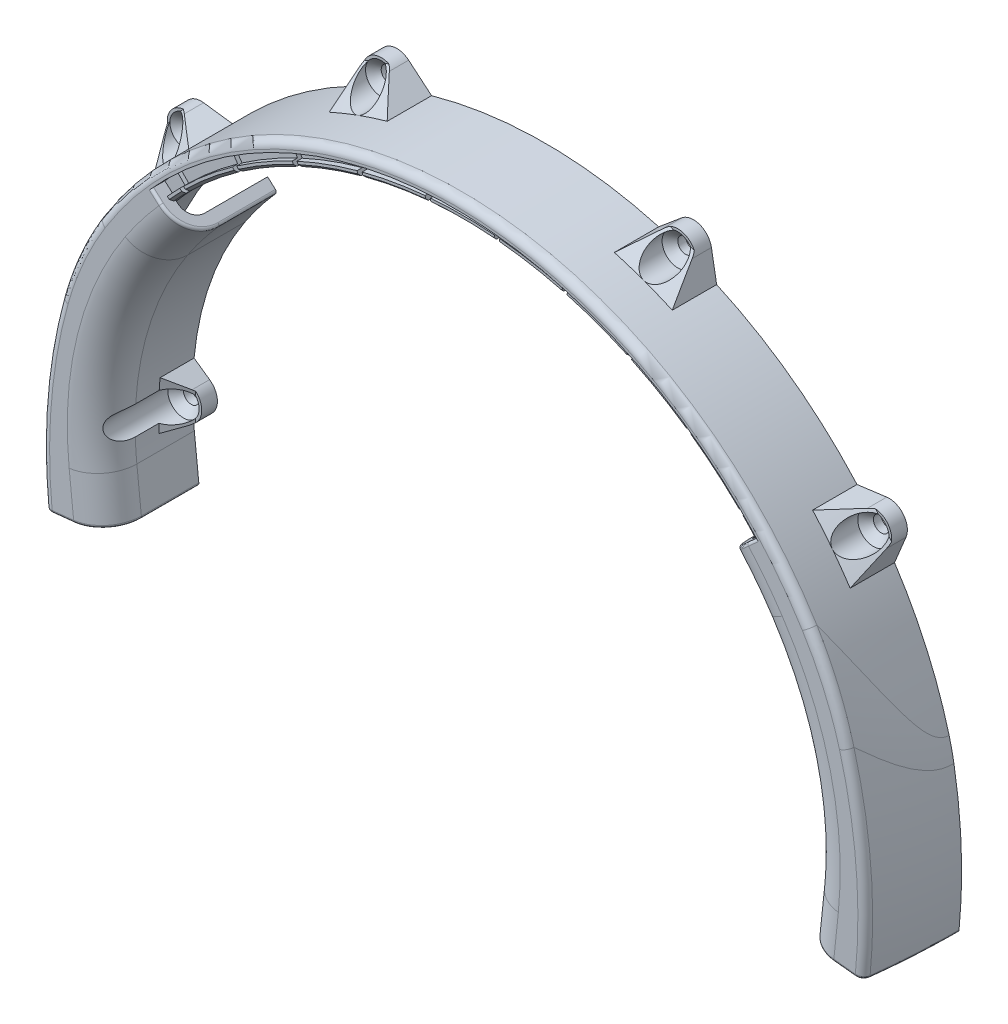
SolidWorks part; units mm, degrees
ref_plane "Front Plane" through (0, 0, 0) normal (0, 0, 1) x (1, 0, 0)
ref_plane "Top Plane" through (0, 0, 0) normal (0, 1, 0) x (1, 0, 0)
ref_plane "Right Plane" through (0, 0, 0) normal (1, 0, 0) x (0, 0, -1)
sketch "Sketch1" plane through (0, 0, 0) normal (0, 0, 1) x (1, 0, 0)
  line L0 (-70, 0) -> (0, 0) construction
  line L1 (18.7039, 80) -> (34.7039, 80) construction
  line L2 (34.7039, 80) -> (34.7039, 78) construction
  line L3 (34.7039, 78) -> (17.2039, 78) construction
  line L5 (17.2039, 74) -> (17.2039, 78.5) construction
  line L6 (0, 75) -> (0, 80)
  line L8 (-68.2435, -10.1892) -> (-66.2545, -9.9802)
  line L9 (-68.2435, -10.1892) -> (-79.1922, -11.34)
  line L10 (21.3539, 78) -> (21.3539, 75) construction
  line L11 (21.3539, 75) -> (18.8539, 75) construction
  line L12 (18.8539, 75) -> (18.8539, 76) construction
  line L13 (18.8539, 76) -> (19.8539, 76) construction
  line L14 (19.8539, 76) -> (19.8539, 78) construction
  line L15 (17.2039, 65.079) -> (17.2039, -3) construction
  line L16 (-68.8386, 34.5) -> (-63.1961, 34.5) construction
  line L17 (17.2039, -3) -> (34.7039, -3) construction
  line L18 (-68.3283, 35.5) -> (-62.6398, 35.5) construction
  line L19 (34.7039, -3) -> (34.7039, 61.6681) construction
  line L20 (-55.7359, 50.1848) -> (-51.277, 46.17)
  line L21 (24.2039, -5.0958) -> (24.2039, 34.5) construction
  line L22 (24.2039, 34.5) -> (27.2039, 34.5) construction
  line L23 (22.7039, 35.5) -> (27.2039, 35.5) construction
  line L24 (24.2039, 38.5) -> (24.2039, 62.5468) construction
  line L25 (27.2039, 34.5) -> (27.2039, 35.5) construction
  line L26 (-66.2545, -9.9802) -> (-67.1677, -1.2914)
  line L27 (22.7039, 35.5) -> (22.7039, 38.5) construction
  line L28 (22.7039, 38.5) -> (24.2039, 38.5) construction
  line L29 (0, 0) -> (-7.5222, 85.9787) construction
  line L30 (0, 0) -> (-8.5013, 48.2135) construction
  line L32 (34.7039, 71.5141) -> (34.7039, 69) construction
  line L33 (34.7039, 71.5) -> (22.2039, 71.5) construction
  line L34 (-7.0346, 74.6694) -> (-7.2961, 77.658)
  line L35 (19.7039, 78) -> (19.7039, 74) construction
  line L36 (-6.0384, 74.7565) -> (-6.2999, 77.7452)
  line L37 (34.7039, 69) -> (22.2039, 69) construction
  line L38 (0, 0) -> (-22.3379, 83.3663) construction
  line L39 (-19.894, 72.3134) -> (-20.6704, 75.2113)
  line L40 (-18.928, 72.5722) -> (-19.7045, 75.4701)
  line L42 (0, 0) -> (-36.475, 78.2208) construction
  line L43 (-32.1488, 67.7603) -> (-33.4167, 70.4792)
  line L44 (-31.2425, 68.1829) -> (-32.5104, 70.9019)
  line L46 (0, 0) -> (-61.0283, 61.0283) construction
  line L48 (-43.4269, 61.1482) -> (-45.1476, 63.6058)
  line L49 (-42.6077, 61.7218) -> (-44.3285, 64.1793)
  line L50 (-53.3854, 52.6783) -> (-55.5067, 54.7996)
  line L51 (-52.6783, 53.3854) -> (-54.7996, 55.5067)
  line L53 (34.7039, 0) -> (29.8878, 0) construction
  arc A4 (0, 80) -> (-79.1922, -11.34) centre (0, 0) ccw
  arc A5 (-58.2174, 51.9108) -> (0, 78) centre (0, 0) cw construction
  arc A6 (-52.6783, 53.3854) -> (-43.4269, 61.1482) centre (0, 0) cw
  arc A7 (-57.4724, 38.1827) -> (-51.277, 46.17) centre (0, 0) cw
  arc A9 (-76.9415, -3) -> (-68.8386, 34.5) centre (0, 0) cw construction
  arc A11 (-71.9375, -3) -> (-63.1961, 34.5) centre (0, 0) cw construction
  arc A12 (-62.6398, 35.5) -> (-53.7391, 47.9177) centre (0, 0) cw construction
  arc A13 (-68.3283, 35.5) -> (-57.471, 51.2453) centre (0, 0) cw construction
  arc A15 (19.7039, 74) -> (22.2039, 71.5) centre (22.2039, 74) ccw construction
  arc A16 (22.2039, 69) -> (17.2039, 74) centre (22.2039, 74) cw construction
  arc A17 (18.7039, 80) -> (17.2039, 78.5) centre (18.7039, 78.5) ccw construction
  arc A18 (-57.4724, 38.1827) -> (-67.1677, -1.2914) centre (-7.4964, 4.9804) ccw
  arc A19 (-7.2961, 77.658) -> (-6.2999, 77.7452) centre (0, 0) cw
  arc A20 (-19.7045, 75.4701) -> (-20.6704, 75.2113) centre (0, 0) ccw
  arc A21 (-32.5104, 70.9019) -> (-33.4167, 70.4792) centre (0, 0) ccw
  arc A22 (-45.1476, 63.6058) -> (-44.3285, 64.1793) centre (0, 0) cw
  arc A23 (-54.7996, 55.5067) -> (-55.5067, 54.7996) centre (0, 0) ccw
  arc A24 (0, 75) -> (-6.0384, 74.7565) centre (0, 0) ccw
  arc A25 (-7.0346, 74.6694) -> (-18.928, 72.5722) centre (0, 0) ccw
  arc A26 (-19.894, 72.3134) -> (-31.2425, 68.1829) centre (0, 0) ccw
  arc A27 (-32.1488, 67.7603) -> (-42.6077, 61.7218) centre (0, 0) ccw
  arc A28 (-53.3854, 52.6783) -> (-55.7359, 50.1848) centre (0, 0) ccw
  dimension "D1" = 2.5
  dimension "D2" = 5
  dimension "D3" = 1.5
extrude "Boss-Extrude1" add sketch "Sketch1" along normal blind 17.5
sketch "Sketch2" plane through (0, 0, 0) normal (0, 0, -1) x (-1, 0, 0)
  line L0 (55.9581, 52.8932) -> (52.4232, 49.3539)
  line L1 (71.2298, -10.5031) -> (76.2065, -11.0261)
  line L18 (-34.7039, -3) -> (-34.7039, 61.6681) construction
  line L47 (-34.7039, 0) -> (-29.8878, 0) construction
  line L48 (0, 0) -> (61.0283, 61.0283) construction
  line L49 (0, 0) -> (36.475, 78.2208) construction
  line L50 (0, 0) -> (22.3379, 83.3663) construction
  line L51 (-34.7039, 69) -> (-22.2039, 69) construction
  line L52 (-19.7039, 78) -> (-19.7039, 74) construction
  line L53 (-34.7039, 71.5) -> (-22.2039, 71.5) construction
  line L54 (-34.7039, 71.5141) -> (-34.7039, 69) construction
  line L55 (0, 0) -> (8.5013, 48.2135) construction
  line L56 (0, 0) -> (7.5222, 85.9787) construction
  line L57 (-22.7039, 38.5) -> (-24.2039, 38.5) construction
  line L58 (-22.7039, 35.5) -> (-22.7039, 38.5) construction
  line L59 (-27.2039, 34.5) -> (-27.2039, 35.5) construction
  line L60 (-24.2039, 38.5) -> (-24.2039, 62.5468) construction
  line L61 (-22.7039, 35.5) -> (-27.2039, 35.5) construction
  line L62 (-24.2039, 34.5) -> (-27.2039, 34.5) construction
  line L63 (-24.2039, -5.0958) -> (-24.2039, 34.5) construction
  line L64 (71.6647, 28.1633) -> (66.0075, 28.7579)
  line L65 (-17.2039, -3) -> (-34.7039, -3) construction
  line L66 (72.0677, 27.1154) -> (66.4562, 27.7052)
  line L67 (-17.2039, 65.079) -> (-17.2039, -3) construction
  line L68 (-19.8539, 76) -> (-19.8539, 78) construction
  line L69 (-18.8539, 76) -> (-19.8539, 76) construction
  line L70 (-18.8539, 75) -> (-18.8539, 76) construction
  line L71 (-21.3539, 75) -> (-18.8539, 75) construction
  line L72 (-21.3539, 78) -> (-21.3539, 75) construction
  line L73 (-17.2039, 74) -> (-17.2039, 78.5) construction
  line L74 (-34.7039, 78) -> (-17.2039, 78) construction
  line L75 (-34.7039, 80) -> (-34.7039, 78) construction
  line L76 (-18.7039, 80) -> (-34.7039, 80) construction
  line L77 (70, 0) -> (0, 0) construction
  line L78 (52.6783, 53.3854) -> (54.7996, 55.5067) construction
  line L79 (53.3854, 52.6783) -> (55.5067, 54.7996) construction
  line L80 (42.6077, 61.7218) -> (44.3285, 64.1793) construction
  line L81 (43.4269, 61.1482) -> (45.1476, 63.6058) construction
  line L82 (31.2425, 68.1829) -> (32.5104, 70.9019) construction
  line L83 (32.1488, 67.7603) -> (33.4167, 70.4792) construction
  line L84 (18.928, 72.5722) -> (19.7045, 75.4701) construction
  line L85 (19.894, 72.3134) -> (20.6704, 75.2113) construction
  line L86 (6.0384, 74.7565) -> (6.2999, 77.7452) construction
  line L87 (7.0346, 74.6694) -> (7.2961, 77.658) construction
  line L88 (66.2545, -9.9802) -> (67.1677, -1.2914) construction
  line L89 (68.2435, -10.1892) -> (79.1922, -11.34) construction
  line L90 (68.2435, -10.1892) -> (66.2545, -9.9802) construction
  line L91 (0, 75) -> (0, 80) construction
  line L92 (51.5, 45.9211) -> (55.9783, 49.9143) construction
  arc A22 (-18.7039, 80) -> (-17.2039, 78.5) centre (-18.7039, 78.5) cw construction
  arc A23 (-22.2039, 69) -> (-17.2039, 74) centre (-22.2039, 74) ccw construction
  arc A24 (-19.7039, 74) -> (-22.2039, 71.5) centre (-22.2039, 74) cw construction
  arc A25 (71.6647, 28.1633) -> (55.9581, 52.8932) centre (0, 0) ccw
  arc A26 (66.0075, 28.7579) -> (52.4232, 49.3539) centre (0, 0) ccw
  arc A27 (71.2298, -10.5031) -> (66.4562, 27.7052) centre (0, 0) ccw
  arc A28 (76.2065, -11.0261) -> (72.0677, 27.1154) centre (0, 0) ccw
  arc A29 (58.2174, 51.9108) -> (0, 78) centre (0, 0) ccw construction
  arc A30 (53.3854, 52.6783) -> (55.9783, 49.9143) centre (0, 0) cw construction
  arc A31 (32.1488, 67.7603) -> (42.6077, 61.7218) centre (0, 0) cw construction
  arc A32 (19.894, 72.3134) -> (31.2425, 68.1829) centre (0, 0) cw construction
  arc A33 (7.0346, 74.6694) -> (18.928, 72.5722) centre (0, 0) cw construction
  arc A34 (0, 75) -> (6.0384, 74.7565) centre (0, 0) cw construction
  arc A35 (54.7996, 55.5067) -> (55.5067, 54.7996) centre (0, 0) cw construction
  arc A36 (45.1476, 63.6058) -> (44.3285, 64.1793) centre (0, 0) ccw construction
  arc A37 (32.5104, 70.9019) -> (33.4167, 70.4792) centre (0, 0) cw construction
  arc A38 (19.7045, 75.4701) -> (20.6704, 75.2113) centre (0, 0) cw construction
  arc A39 (7.2961, 77.658) -> (6.2999, 77.7452) centre (0, 0) ccw construction
  arc A40 (53.1664, 43.981) -> (66.9348, 5.7367) centre (6.9348, 5.7367) cw construction
  arc A41 (53.1664, 43.981) -> (51.5, 45.9211) centre (0, 0) ccw construction
  arc A42 (52.6783, 53.3854) -> (43.4269, 61.1482) centre (0, 0) ccw construction
  arc A43 (0, 80) -> (79.9437, -3) centre (0, 0) cw construction
extrude "Cut-Extrude1" cut sketch "Sketch2" against normal blind 10.5
sketch "Sketch3" plane through (0, 0, 10.5) normal (0, 0, -1) x (-1, 0, 0)
  line L0 (66.0075, 28.7579) -> (71.6647, 28.1633)
  line L2 (70.343, 31.3187) -> (64.5331, 31.9294)
  arc A0 (64.5331, 31.9294) -> (66.0075, 28.7579) centre (0, 0) cw
  arc A3 (70.343, 31.3187) -> (71.6647, 28.1633) centre (0, 0) cw
extrude "Cut-Extrude2" cut sketch "Sketch3" against normal blind 1.5
sketch "Sketch4" plane through (0, 0, 0) normal (0, 0, -1) x (-1, 0, 0)
  line L0 (65.3884, 30.1391) -> (69.5964, 32.9445)
  line L1 (67.6445, 24.6621) -> (73.2563, 23.7174)
  arc A0 (65.3884, 30.1391) -> (67.6445, 24.6621) centre (0, 0) cw
  arc A3 (69.5964, 32.9445) -> (73.2563, 23.7174) centre (0, 0) cw
extrude "Cut-Extrude3" cut sketch "Sketch4" against normal blind 7.5
sketch "Sketch10" plane through (0.3136, -2.9836, 0) normal (0.1045, -0.9945, 0) x (0.9945, 0.1045, 0)
  line L0 (-79.9437, 0) -> (-81.9555, 0)
  line L1 (-79.9437, 0) -> (20.0563, 0) construction
  line L2 (-81.9555, 0) -> (-81.9555, 19.3703)
  line L3 (-81.9555, 19.3703) -> (-78.6878, 19.3703)
  line L4 (20.0563, 0) -> (20.0563, 10.203) construction
  arc A0 (-79.9437, 0) -> (-78.6878, 19.3703) centre (70.0563, 0) cw
revolve "Cut-Revolve3" cut sketch "Sketch10" angle 360 about L4
fillet "Fillet5" radius 50 1 edges at (-76.6546, 22.8927, 7.9469)
fillet "Fillet1" radius 6.5 3 edges at (-66.7111, -5.6358, 17.5) (-54.5212, 42.29, 17.5) (-65.7646, 19.2917, 17.5)
fillet "Fillet2" radius 1.5 3 edges at (-37.5172, 70.6573, 17.5) (-78.3242, 7.9073, 17.5)
sketch "Sketch5" plane through (0, 0, 0) normal (0.6691, 0.7431, 0) x (0.7431, -0.6691, 0)
  line L0 (-80, -16) -> (-80, 0) construction
  line L1 (-80, 0) -> (-78, 0) construction
  line L2 (-78, 0) -> (-78, -13.35)
  line L3 (-74, -17.5) -> (-78.5, -17.5) construction
  line L4 (-78, -13.35) -> (-75, -13.35)
  line L5 (-75, -13.35) -> (-75, -15)
  line L6 (-75, -15.85) -> (-76, -15.85) construction
  line L7 (-76, -15.85) -> (-76, -14.85) construction
  line L8 (-76, -14.85) -> (-78, -14.85) construction
  line L9 (-71.5141, 0) -> (-69, 0) construction
  line L10 (-71.5, 0) -> (-71.5, -12)
  line L11 (-75, -15) -> (-74.5, -15)
  line L12 (-69, 0) -> (-69, -12.5) construction
  line L13 (0, 0) -> (0, 10.351) construction
  line L14 (-78, 0) -> (-71.5, 0)
  arc A1 (-69, -12.5) -> (-74, -17.5) centre (-74, -12.5) cw construction
  arc A2 (-80, -16) -> (-78.5, -17.5) centre (-78.5, -16) ccw construction
  arc A3 (-71.5, -12) -> (-74.5, -15) centre (-74.5, -12) cw
  dimension "D1" = 3
  dimension "D2" = 5
  dimension "D3" = 1.5
revolve "Cut-Revolve1" cut sketch "Sketch5" angle 5 about L13
sketch "Sketch6" plane through (0, 0, 0) normal (1, 0, 0) x (0, 0, -1)
  line L0 (-16, 80) -> (0, 80) construction
  line L1 (0, 80) -> (0, 78) construction
  line L2 (0, 78) -> (-17.5, 78) construction
  line L3 (-17.5, 74) -> (-17.5, 78.5) construction
  line L4 (-13.35, 78) -> (-13.35, 74)
  line L5 (-13.35, 75) -> (-15.85, 75) construction
  line L6 (-15.85, 74) -> (-15.85, 76)
  line L7 (-15.85, 76) -> (-14.85, 76)
  line L8 (-14.85, 76) -> (-14.85, 78)
  line L9 (0, 71.5141) -> (0, 69) construction
  line L10 (0, 71.5) -> (-12.5, 71.5) construction
  line L11 (-15, 78) -> (-15, 74) construction
  line L12 (0, 69) -> (-12.5, 69) construction
  line L13 (0, 0) -> (-22.4346, 0) construction
  line L14 (-14.85, 78) -> (-18.2384, 78)
  line L15 (-18.2384, 78) -> (-18.2384, 74)
  line L16 (-18.2384, 74) -> (-15.85, 74)
  line L17 (-13.35, 78) -> (0.5027, 78)
  line L18 (0.5027, 78) -> (0.5027, 74)
  line L19 (0.5027, 74) -> (-13.35, 74)
  arc A0 (-15, 74) -> (-12.5, 71.5) centre (-12.5, 74) ccw construction
  arc A1 (-12.5, 69) -> (-17.5, 74) centre (-12.5, 74) cw construction
  arc A2 (-16, 80) -> (-17.5, 78.5) centre (-16, 78.5) ccw construction
  dimension "D1" = 2.5
  dimension "D2" = 5
  dimension "D3" = 1.5
revolve "Cut-Revolve2" cut sketch "Sketch6" angle 48 about L13
fillet "Fillet3" radius 0.5 8 edges at (-57.0364, 51.3558, 17.5) (-52.6918, 47.4439, 15.5962) (-51.277, 46.17, 5.5) (-66.2545, -9.9802, 5.5) (-68.1479, -10.1792, 15.5962) (-74.7798, -10.8762, 17.5) (-78.9749, -11.3171, 8.0926) (-77.8371, -11.1975, 17.1163)
fillet "Fillet4" radius 1 8 edges at (-76.5506, 8.3065, 10.5) (-71.8681, 27.6401, 7.5) (-71.0214, 29.7483, 12) (-66.3454, 39.0805, 10.5) (-66.2339, 28.2324, 7.5) (-61.2831, 37.7939, 10.5) (-65.2895, 30.3526, 12) (-71.4446, 8.9261, 10.5)
sketch "Sketch7" plane through (0, 0, 0) normal (0, 0, 1) x (1, 0, 0)
  line L0 (-53.4449, 44.8495) -> (-60.6341, 34.9008) construction
  line L1 (-69.0819, 49.1878) -> (-66.4225, 42.7674)
  line L2 (-63.9348, 5.5936) -> (-82.6842, 7.2339) construction
  line L3 (-65.3915, 53.9973) -> (-58.5016, 53.0902)
  line L4 (-64.2394, 8.6629) -> (-68.9683, 11.9741)
  line L5 (0, 0) -> (-94.6624, 0) construction
  line L6 (-64.7678, 2.6238) -> (-69.9998, 0.1841)
  line L7 (-52.5723, 36.8115) -> (-67.9896, 47.6068) construction
  line L8 (-24.8627, 81.0777) -> (-26.6614, 74.3651) construction
  line L9 (-50.8647, 39.3161) -> (-53.4449, 44.8495) construction
  line L10 (-54.3418, 34.3503) -> (-60.6341, 34.9008) construction
  line L11 (-31.8345, 78.6023) -> (-33.0412, 71.7585)
  line L12 (-26.1379, 80.6756) -> (-20.8144, 76.2087)
  line L13 (-19.0071, 82.6467) -> (-14.0932, 77.7328) construction
  circle A0 centre (-66.2469, 5.7959) radius 1.5
  arc A2 (-64.7678, 2.6238) -> (-64.2394, 8.6629) centre (-66.2469, 5.7959) ccw
  arc A4 (-68.9683, 11.9741) -> (-69.9998, 0.1841) centre (0, 0) ccw
  arc A5 (-20.8144, 76.2087) -> (-33.0412, 71.7585) centre (0, 0) ccw
  arc A7 (-69.0819, 49.1878) -> (-65.3915, 53.9973) centre (-65.8483, 50.5272) cw
  circle A8 centre (-65.8483, 50.5272) radius 1.5
  arc A10 (-66.4225, 42.7674) -> (-58.5016, 53.0902) centre (0, 0) cw
  circle A11 centre (-28.3877, 77.9945) radius 1.5
  arc A12 (-26.1379, 80.6756) -> (-31.8345, 78.6023) centre (-28.3877, 77.9945) ccw
  arc A14 (-50.8647, 39.3161) -> (-54.3418, 34.3503) centre (-54.0367, 37.8369) cw construction
  circle A15 centre (-54.0367, 37.8369) radius 1.5 construction
  arc A16 (-14.0932, 77.7328) -> (-26.6614, 74.3651) centre (0, 0) ccw construction
  circle A17 centre (-21.482, 80.1718) radius 1.5 construction
  arc A18 (-19.0071, 82.6467) -> (-24.8627, 81.0777) centre (-21.482, 80.1718) ccw construction
  circle A20 centre (-66.2469, 5.7959) radius 3.5 construction
extrude "Boss-Extrude2" add sketch "Sketch7" along normal blind 3
sketch "Sketch8" plane through (0, 0, 0) normal (0, 0, -1) x (-1, 0, 0)
  circle A0 centre (66.2469, 5.7959) radius 1.5
extrude "Cut-Extrude4" cut sketch "Sketch8" against normal blind 20
chamfer "Chamfer2" distance 3.5 angle 45 1 edges at (-67.3806, 8.7067, 3)
chamfer "Chamfer3" distance 5.5 angle 45 2 edges at (-27.3616, 75.1754, 3) (-63.4683, 48.7009, 3)
sketch "Sketch9" plane through (0, 0, 3) normal (0, 0, 1) x (1, 0, 0)
  circle A0 centre (-66.2469, 5.7959) radius 3
  circle A2 centre (-65.8483, 50.5272) radius 3
  circle A3 centre (-28.3877, 77.9945) radius 3
extrude "Cut-Extrude5" cut sketch "Sketch9" along normal blind 20
chamfer "Chamfer4" distance 1.5 angle 45 3 edges at (-26.8877, 77.9945, 3) (-64.3483, 50.5272, 3) (-64.7469, 5.7959, 3)
chamfer "Chamfer5" distance 0.5 angle 45 6 edges at (-3.0217, 74.9391, 15.85) (-13.0236, 73.8606, 15.85) (-25.6515, 70.4769, 15.85) (-37.5, 64.9519, 15.85) (-48.2091, 57.4533, 15.85) (-54.5749, 51.445, 15.85)
mirror "Mirror1" about plane through (0, 75, 17.5) normal (-1, 0, 0)
